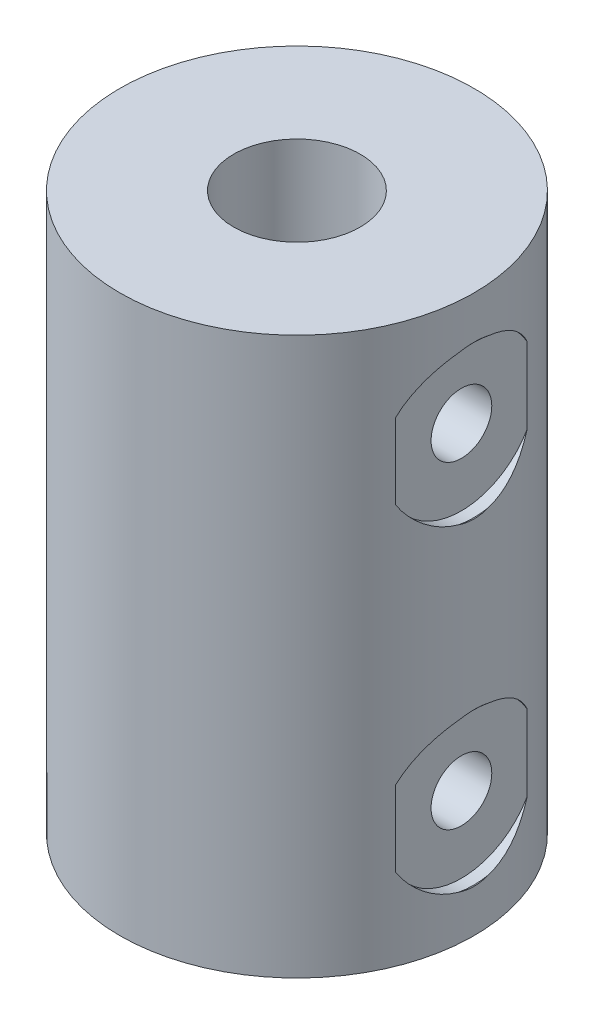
SolidWorks part; units mm, degrees
ref_plane "前视基准面" through (0, 0, 0) normal (0, 0, 1) x (1, 0, 0)
ref_plane "上视基准面" through (0, 0, 0) normal (0, 1, 0) x (1, 0, 0)
ref_plane "右视基准面" through (0, 0, 0) normal (1, 0, 0) x (0, 0, -1)
sketch "草图2" plane through (0, 0, 0) normal (0, 1, 0) x (1, 0, 0)
  circle A0 centre (0, 0) radius 7
  dimension "D1" = 14
extrude "凸台-拉伸1" add sketch "草图2" along normal mid plane 22
sketch "草图3" plane through (0, 11, 0) normal (0, 1, 0) x (1, 0, 0)
  circle A0 centre (0, 0) radius 2.5
  dimension "D1" = 5
extrude "切除-拉伸1" cut sketch "草图3" against normal through all both and the other way through all
ref_plane "基准面1" through (7, 0, 0) normal (1, 0, 0) x (0, 0, -1)
sketch "草图4" plane through (7, 0, 0) normal (1, 0, 0) x (0, 0, -1)
  line L0 (0, 10.0317) -> (0, -9.3658) construction
  line L1 (-6.5567, 0) -> (5.7514, 0) construction
  line L2 (-3.9356, 6.2872) -> (3.6146, 6.2872) construction
  line L3 (-3.9356, -6.2872) -> (3.6146, -6.2872) construction
  point P10 (0, 6.2872)
  point P12 (-0.1605, -6.2872)
sketch "草图7" plane through (7, 0, 0) normal (1, 0, 0) x (0, 0, -1)
  line L0 (0, 10.0317) -> (0, -9.3658) construction
  line L1 (-3.9356, -6.2872) -> (3.6146, -6.2872) construction
  point P0 (0, -6.2872)
  point P6 (0, 6.2872)
hole_wizard "M2 六角头螺栓全螺纹 AB 级的柱形沉头孔1" positions "草图7" profile "草图8" counterbore size "M2" standard "GB"
sketch "草图8" plane through (7, -6.2872, 0) normal (0, 1, 0) x (0, 0, -1)
  line L0 (0, 0) -> (0, 7.721)
  line L1 (0, 7.721) -> (1.2, 7)
  line L2 (1.2, 7) -> (1.2, 0.5)
  line L3 (1.2, 0.5) -> (3, 0.5)
  line L5 (3, 0.5) -> (3, 0.025)
  line L6 (3, 0.025) -> (3.025, 0)
  line L7 (3.025, 0) -> (0, 0)
  line L8 (-3, 0.025) -> (-3.025, 0) construction
  line L10 (0, 7.721) -> (-1.2, 7) construction
  line L11 (0, -6.35) -> (0, 107.95) construction
  dimension "孔直径" = 2.4
  dimension "孔深度" = 7
  dimension "锥形沉头孔直径" = 6
  dimension "锥形沉头孔深度" = 0.5
  dimension "近端锥形沉头孔直径" = 6.05
  dimension "近端锥形沉头孔角度" = 90
  dimension "导头角度" = 118
